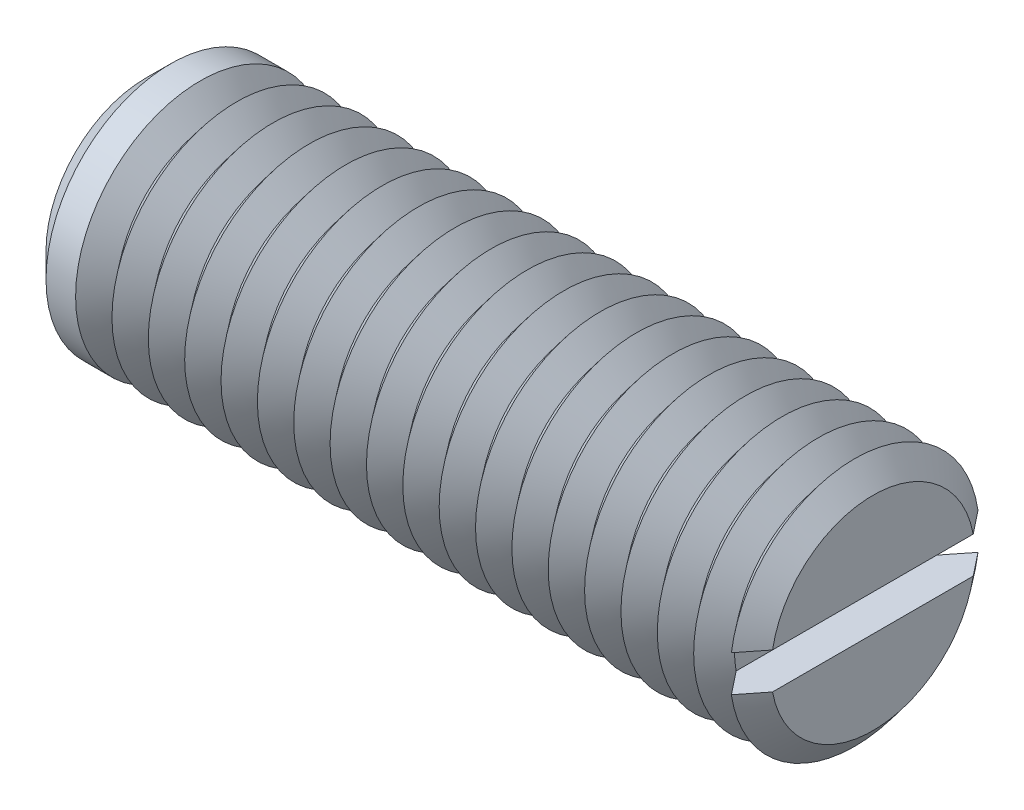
SolidWorks part; units mm, degrees
ref_plane "Front Plane" through (0, 0, 0) normal (0, 0, 1) x (1, 0, 0)
ref_plane "Top Plane" through (0, 0, 0) normal (0, 1, 0) x (1, 0, 0)
ref_plane "Right Plane" through (0, 0, 0) normal (1, 0, 0) x (0, 0, -1)
sketch "Sketch1" plane through (0, 0, 0) normal (1, 0, 0) x (0, 0, -1)
  circle A0 centre (0, 0) radius 6
  dimension "D1" = 12
extrude "Extrude1" add sketch "Sketch1" along normal mid plane 35
sketch "Sketch2" plane through (0, 0, 0) normal (0, 0, 1) x (1, 0, 0)
  line L0 (17.5, 0.875) -> (15.75, 0.875)
  line L1 (17.5, -6) -> (17.5, 6) construction
  line L2 (15.75, 0.875) -> (15.75, -0.875)
  line L3 (0, 0) -> (50000, 0) construction
  line L4 (17.5, -0.875) -> (15.75, -0.875)
  line L5 (17.5, -0.875) -> (17.5, 0.875)
  point P9 (15.75, 0)
  dimension "D1" = 1.75
extrude "Extrude2" cut sketch "Sketch2" against normal mid plane 18
chamfer "Chamfer1" distance 1.2 angle 45 1 edges at (-17.5, 0, -6)
sketch "Sketch3" plane through (0, 0, 0) normal (0, 0, 1) x (1, 0, 0)
  line L0 (0, 0) -> (30.9602, 0) construction
  line L1 (16.625, -6) -> (18.375, -6)
  line L2 (-16.3, -6) -> (17.5, -6) construction
  line L3 (18.375, -6) -> (17.5, -4.9071)
  line L4 (17.5, -6) -> (17.5, -0.875) construction
  line L5 (17.5, -4.9071) -> (16.625, -6)
  dimension "D1" = 1.75
  dimension "D2" = 1.4
revolve "Cut-Revolve1" cut sketch "Sketch3" angle 360 about L0
pattern_linear "LPattern1" count 19 spacing 1.75 along (-1, 0, 0) of "Cut-Revolve1"
equation "\"D2@Sketch3\" = \"D1@Sketch3\"*0.8"
